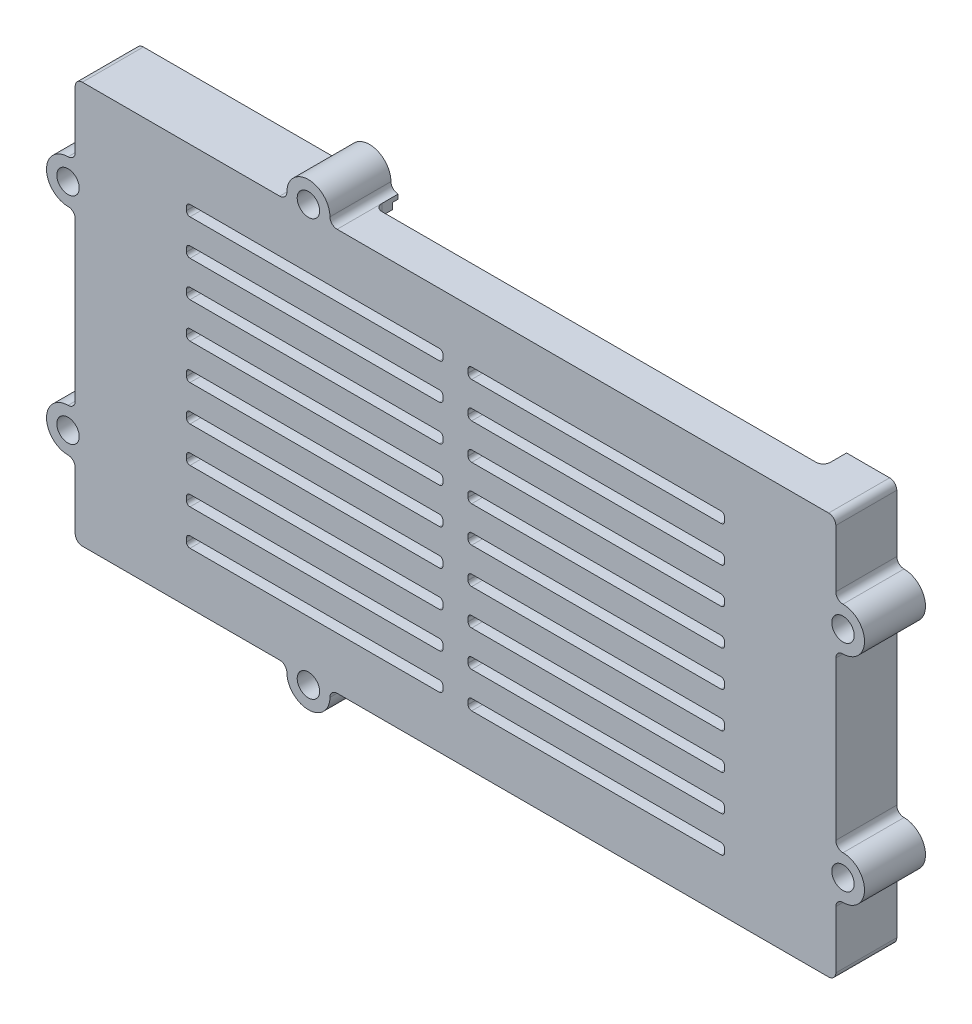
SolidWorks part; units mm, degrees
ref_plane "Alzado" through (0, 0, 0) normal (0, 0, 1) x (1, 0, 0)
ref_plane "Planta" through (0, 0, 0) normal (0, 1, 0) x (1, 0, 0)
ref_plane "Vista lateral" through (0, 0, 0) normal (1, 0, 0) x (0, 0, -1)
sketch "Croquis1" plane through (0, 0, 0) normal (0, 0, 1) x (1, 0, 0)
  line L0 (-96, -46) -> (96, 46) construction
  line L1 (-100, -50) -> (100, -50)
  line L2 (-100, -50) -> (-100, 50)
  line L3 (-100, 50) -> (100, 50)
  line L4 (100, -50) -> (100, 50)
  line L5 (-100, -50) -> (100, 50) construction
  line L6 (-100, 50) -> (100, -50) construction
  circle A0 centre (-96, 46) radius 1.75
  circle A1 centre (-96, -46) radius 1.75
  circle A2 centre (96, -46) radius 1.75
  circle A3 centre (96, 46) radius 1.75
  point P0 (0, 0)
  dimension "D3" = 3.5
  dimension "D4" = 192
  dimension "D5" = 92
  dimension "D1" = 200
  dimension "D2" = 100
sketch "Croquis2" plane through (0, 0, 0) normal (0, 0, 1) x (1, 0, 0)
  circle A0 centre (0, 0) radius 130
  dimension "D1" = 260
sketch "Croquis3" plane through (0, 0, 0) normal (0, 0, 1) x (1, 0, 0)
  line L0 (-100, 50) -> (100, 50) construction
  line L1 (-106, -56) -> (106, -56)
  line L2 (-106, -56) -> (-106, 56)
  line L3 (-106, 56) -> (106, 56)
  line L4 (106, -56) -> (106, 56)
  line L5 (-106, -56) -> (106, 56) construction
  line L6 (-106, 56) -> (106, -56) construction
  line L7 (-100, -50) -> (-100, 50) construction
  line L8 (-100, -50) -> (100, -50) construction
  line L9 (100, -50) -> (100, 50) construction
  circle A0 centre (-41, -58) radius 6
  circle A1 centre (-108, -30) radius 6
  circle A2 centre (-108, 30) radius 6
  circle A3 centre (-41, 58) radius 6
  circle A4 centre (108, -30) radius 6
  circle A5 centre (108, 30) radius 6
  point P0 (0, 0)
sketch "Croquis8" plane through (0, 0, 0) normal (0, 0, 1) x (1, 0, 0)
  line L0 (106, -56) -> (106, 56) construction
  line L1 (-106, 56) -> (106, 56) construction
  line L2 (-106, -56) -> (-106, 56) construction
  line L3 (-106, -56) -> (106, -56) construction
  line L4 (106, -56) -> (106, -35.6569)
  line L5 (-106, 56) -> (-46.6569, 56)
  line L6 (-106, -56) -> (-106, -35.6569)
  line L7 (-106, -56) -> (-46.6569, -56)
  line L8 (-35.3431, -56) -> (106, -56)
  line L9 (-106, -24.3431) -> (-106, 24.3431)
  line L10 (-106, 35.6569) -> (-106, 56)
  line L11 (-35.3431, 56) -> (106, 56)
  line L12 (106, 35.6569) -> (106, 56)
  line L13 (106, -24.3431) -> (106, 24.3431)
  circle A0 centre (108, 30) radius 6 construction
  circle A1 centre (-41, 58) radius 6 construction
  circle A2 centre (-108, 30) radius 6 construction
  circle A3 centre (-108, -30) radius 6 construction
  circle A4 centre (-41, -58) radius 6 construction
  circle A5 centre (108, -30) radius 6 construction
  arc A6 (106, 24.3431) -> (106, 35.6569) centre (108, 30) ccw
  arc A7 (-35.3431, 56) -> (-46.6569, 56) centre (-41, 58) ccw
  arc A8 (-106, 35.6569) -> (-106, 24.3431) centre (-108, 30) ccw
  arc A9 (-106, -24.3431) -> (-106, -35.6569) centre (-108, -30) ccw
  arc A10 (-46.6569, -56) -> (-35.3431, -56) centre (-41, -58) ccw
  arc A11 (106, -35.6569) -> (106, -24.3431) centre (108, -30) ccw
extrude "Saliente-Extruir5" add sketch "Croquis8" along normal blind 15.5
sketch "Croquis9" plane through (0, 0, 0) normal (0, 0, 1) x (1, 0, 0)
  line L0 (106, -56) -> (106, 56) construction
  line L1 (-106, -56) -> (106, -56) construction
  line L2 (-106, -56) -> (-106, 56) construction
  line L3 (-106, 56) -> (106, 56) construction
  line L4 (106, -56) -> (106, 56) construction
  line L5 (-106, -56) -> (106, -56) construction
  line L6 (-106, -56) -> (-106, 56) construction
  line L7 (-106, 56) -> (106, 56) construction
  line L8 (-103, 53) -> (-44.3166, 53)
  line L9 (103, -53) -> (103, -33.3166)
  line L10 (-103, -53) -> (-44.3166, -53)
  line L11 (-103, -53) -> (-103, -33.3166)
  line L12 (-37.6834, 53) -> (103, 53)
  line L13 (-103, 33.3166) -> (-103, 53)
  line L14 (-103, 53) -> (103, 53) construction
  line L15 (-103, -26.6834) -> (-103, 26.6834)
  line L16 (-103, -53) -> (-103, 53) construction
  line L17 (-37.6834, -53) -> (103, -53)
  line L18 (103, -26.6834) -> (103, 26.6834)
  line L19 (-103, -53) -> (103, -53) construction
  line L20 (103, 33.3166) -> (103, 53)
  line L21 (103, -53) -> (103, 53) construction
  line L22 (-100, -50) -> (100, -50) construction
  line L23 (-7.5, -50) -> (7.5, -50)
  line L24 (-7.5, -50) -> (-7.5, -47)
  line L25 (-7.5, -47) -> (7.5, -47)
  line L26 (7.5, -50) -> (7.5, -47)
  line L27 (0, -50) -> (0, 0) construction
  line L28 (-100, 50) -> (100, 50) construction
  line L29 (-7.5, 50) -> (7.5, 50)
  line L30 (-7.5, 50) -> (-7.5, 47)
  line L31 (-7.5, 47) -> (7.5, 47)
  line L32 (7.5, 50) -> (7.5, 47)
  circle A0 centre (-41, 58) radius 6 construction
  circle A1 centre (-108, 30) radius 6 construction
  circle A2 centre (-108, -30) radius 6 construction
  circle A3 centre (-41, -58) radius 6 construction
  circle A4 centre (108, -30) radius 6 construction
  circle A5 centre (108, 30) radius 6 construction
  arc A6 (-103, 26.6834) -> (-103, 33.3166) centre (-108, 30) ccw
  arc A7 (-103, -33.3166) -> (-103, -26.6834) centre (-108, -30) ccw
  arc A8 (-37.6834, -53) -> (-44.3166, -53) centre (-41, -58) ccw
  arc A9 (103, -26.6834) -> (103, -33.3166) centre (108, -30) ccw
  arc A10 (103, 33.3166) -> (103, 26.6834) centre (108, 30) ccw
  arc A11 (-44.3166, 53) -> (-37.6834, 53) centre (-41, 58) ccw
  circle A12 centre (96, 46) radius 1.15 construction
  circle A13 centre (96, 46) radius 4
  circle A14 centre (-96, 46) radius 1.15 construction
  circle A15 centre (-96, 46) radius 4
  circle A16 centre (-96, -46) radius 1.15 construction
  circle A17 centre (-96, -46) radius 4
  circle A18 centre (96, -46) radius 1.15 construction
  circle A19 centre (96, -46) radius 4
  dimension "D2" = 2.3
  dimension "D3" = 8
  dimension "D4" = 15
  dimension "D5" = 3
  dimension "D6" = 3
  dimension "D1" = 3
extrude "Cortar-Extruir1" cut sketch "Croquis9" along normal blind 12.5
sketch "Croquis14" plane through (0, 0, 15.5) normal (0, 0, 1) x (1, 0, 0)
  circle A0 centre (-41, 58) radius 6 construction
  circle A1 centre (-108, -30) radius 6 construction
  circle A2 centre (-41, -58) radius 6 construction
  circle A3 centre (108, 30) radius 6 construction
  circle A4 centre (108, -30) radius 6 construction
  circle A5 centre (-41, 58) radius 6
  circle A6 centre (-108, -30) radius 6
  circle A7 centre (-41, -58) radius 6
  circle A8 centre (108, 30) radius 6
  circle A9 centre (108, -30) radius 6
  circle A10 centre (-108, 30) radius 6 construction
  circle A11 centre (-108, 30) radius 6
sketch "Croquis17" plane through (0, 0, 12.5) normal (0, 0, -1) x (-1, 0, 0)
  line L0 (-7.5, -47) -> (7.5, -47) construction
  line L1 (1.5, 47) -> (-1.5, 47)
  line L2 (1.5, 47) -> (1.5, -47)
  line L3 (1.5, -47) -> (-1.5, -47)
  line L4 (-1.5, 47) -> (-1.5, -47)
  line L5 (1.5, 47) -> (-1.5, -47) construction
  line L6 (1.5, -47) -> (-1.5, 47) construction
  point P0 (0, 0)
  dimension "D1" = 3
extrude "Saliente-Extruir8" add sketch "Croquis17" along normal blind 5
fillet "Redondeo4" radius 2 52 edges at (-102, 30, 12.5) (-103, 0, 12.5) (-102, -30, 12.5) (-103, -43.1583, 12.5) (-73.6583, -53, 12.5) (-41, -52, 12.5) (32.6583, -53, 12.5) (103, -43.1583, 12.5) (102, -30, 12.5) (103, 0, 12.5) (102, 30, 12.5) (103, 43.1583, 12.5) (32.6583, 53, 12.5) (-41, 52, 12.5) (-73.6583, 53, 12.5) (-103, 43.1583, 12.5) (-106, -56, 7.75) (-106, 56, 7.75) (106, 56, 7.75) (106, -56, 7.75) (-103, -53, 6.25) (-103, 53, 6.25) (103, -53, 6.25) (103, 53, 6.25) (106, 35.6569, 7.75) (106, 24.3431, 7.75) (106, -24.3431, 7.75) (106, -35.6569, 7.75) (-35.3431, -56, 7.75) (-46.6569, -56, 7.75) (-106, -35.6569, 7.75) (-106, -24.3431, 7.75) (-106, 24.3431, 7.75) (-106, 35.6569, 7.75) (-46.6569, 56, 7.75) (-35.3431, 56, 7.75) (100, -46, 12.5) (-92, 46, 12.5) (100, 46, 12.5) (-92, -46, 12.5) (-7.5, 48.5, 12.5) (0, 50, 12.5) (7.5, 48.5, 12.5) (4.5, 47, 12.5) (-4.5, 47, 12.5) (-7.5, -48.5, 12.5) (-4.5, -47, 12.5) (4.5, -47, 12.5) (7.5, -48.5, 12.5) (0, -50, 12.5) (-1.5, 0, 12.5) (1.5, 0, 12.5)
sketch "Croquis10" plane through (0, 0, 0) normal (0, 0, 1) x (1, 0, 0)
  line L0 (-104, -54.75) -> (-49, -54.75)
  line L1 (-33, -54.75) -> (104, -54.75)
  line L2 (104.75, -54) -> (104.75, -38)
  line L3 (104.75, -22) -> (104.75, 22)
  line L4 (104.75, 38) -> (104.75, 54)
  line L5 (104, 54.75) -> (-33, 54.75)
  line L6 (-49, 54.75) -> (-104, 54.75)
  line L7 (-104.75, 54) -> (-104.75, 38)
  line L8 (-104.75, 22) -> (-104.75, -22)
  line L9 (-104.75, -38) -> (-104.75, -54)
  line L10 (-104, -56) -> (-49, -56)
  line L11 (-106, -38) -> (-106, -54)
  line L12 (-106, 22) -> (-106, -22)
  line L13 (-106, 54) -> (-106, 38)
  line L14 (-49, 56) -> (-104, 56)
  line L15 (104, 56) -> (-33, 56)
  line L16 (106, 38) -> (106, 54)
  line L17 (106, -22) -> (106, 22)
  line L18 (106, -54) -> (106, -38)
  line L19 (-33, -56) -> (104, -56)
  line L20 (-104, -56) -> (-49, -56)
  line L21 (-106, -38) -> (-106, -54)
  line L22 (-106, 22) -> (-106, -22)
  line L23 (-106, 54) -> (-106, 38)
  line L24 (-49, 56) -> (-104, 56)
  line L25 (104, 56) -> (-33, 56)
  line L26 (106, 38) -> (106, 54)
  line L27 (106, -22) -> (106, 22)
  line L28 (106, -54) -> (106, -38)
  line L29 (-33, -56) -> (104, -56)
  arc A0 (-45.75, -58) -> (-49, -54.75) centre (-49, -58) ccw
  arc A1 (-45.75, -58) -> (-36.25, -58) centre (-41, -58) ccw
  arc A2 (-33, -54.75) -> (-36.25, -58) centre (-33, -58) ccw
  arc A3 (104, -54.75) -> (104.75, -54) centre (104, -54) ccw
  arc A4 (108, -34.75) -> (104.75, -38) centre (108, -38) ccw
  arc A5 (108, -34.75) -> (108, -25.25) centre (108, -30) ccw
  arc A6 (104.75, -22) -> (108, -25.25) centre (108, -22) ccw
  arc A7 (108, 25.25) -> (104.75, 22) centre (108, 22) ccw
  arc A8 (108, 25.25) -> (108, 34.75) centre (108, 30) ccw
  arc A9 (104.75, 38) -> (108, 34.75) centre (108, 38) ccw
  arc A10 (104.75, 54) -> (104, 54.75) centre (104, 54) ccw
  arc A11 (-36.25, 58) -> (-33, 54.75) centre (-33, 58) ccw
  arc A12 (-36.25, 58) -> (-45.75, 58) centre (-41, 58) ccw
  arc A13 (-49, 54.75) -> (-45.75, 58) centre (-49, 58) ccw
  arc A14 (-104, 54.75) -> (-104.75, 54) centre (-104, 54) ccw
  arc A15 (-108, 34.75) -> (-104.75, 38) centre (-108, 38) ccw
  arc A16 (-108, 34.75) -> (-108, 25.25) centre (-108, 30) ccw
  arc A17 (-104.75, 22) -> (-108, 25.25) centre (-108, 22) ccw
  arc A18 (-108, -25.25) -> (-104.75, -22) centre (-108, -22) ccw
  arc A19 (-108, -25.25) -> (-108, -34.75) centre (-108, -30) ccw
  arc A20 (-104.75, -38) -> (-108, -34.75) centre (-108, -38) ccw
  arc A21 (-104.75, -54) -> (-104, -54.75) centre (-104, -54) ccw
  arc A22 (-106, -54) -> (-104, -56) centre (-104, -54) ccw
  arc A23 (-106, -38) -> (-108, -36) centre (-108, -38) ccw
  arc A24 (-108, -24) -> (-108, -36) centre (-108, -30) ccw
  arc A25 (-108, -24) -> (-106, -22) centre (-108, -22) ccw
  arc A26 (-106, 22) -> (-108, 24) centre (-108, 22) ccw
  arc A27 (-108, 36) -> (-108, 24) centre (-108, 30) ccw
  arc A28 (-108, 36) -> (-106, 38) centre (-108, 38) ccw
  arc A29 (-104, 56) -> (-106, 54) centre (-104, 54) ccw
  arc A30 (-49, 56) -> (-47, 58) centre (-49, 58) ccw
  arc A31 (-35, 58) -> (-47, 58) centre (-41, 58) ccw
  arc A32 (-35, 58) -> (-33, 56) centre (-33, 58) ccw
  arc A33 (106, 54) -> (104, 56) centre (104, 54) ccw
  arc A34 (106, 38) -> (108, 36) centre (108, 38) ccw
  arc A35 (108, 24) -> (108, 36) centre (108, 30) ccw
  arc A36 (108, 24) -> (106, 22) centre (108, 22) ccw
  arc A37 (106, -22) -> (108, -24) centre (108, -22) ccw
  arc A38 (108, -36) -> (108, -24) centre (108, -30) ccw
  arc A39 (108, -36) -> (106, -38) centre (108, -38) ccw
  arc A40 (104, -56) -> (106, -54) centre (104, -54) ccw
  arc A41 (-33, -56) -> (-35, -58) centre (-33, -58) ccw
  arc A42 (-47, -58) -> (-35, -58) centre (-41, -58) ccw
  arc A43 (-47, -58) -> (-49, -56) centre (-49, -58) ccw
  arc A44 (-106, -54) -> (-104, -56) centre (-104, -54) ccw
  arc A45 (-106, -38) -> (-108, -36) centre (-108, -38) ccw
  arc A46 (-108, -24) -> (-108, -36) centre (-108, -30) ccw
  arc A47 (-108, -24) -> (-106, -22) centre (-108, -22) ccw
  arc A48 (-106, 22) -> (-108, 24) centre (-108, 22) ccw
  arc A49 (-108, 36) -> (-108, 24) centre (-108, 30) ccw
  arc A50 (-108, 36) -> (-106, 38) centre (-108, 38) ccw
  arc A51 (-104, 56) -> (-106, 54) centre (-104, 54) ccw
  arc A52 (-49, 56) -> (-47, 58) centre (-49, 58) ccw
  arc A53 (-35, 58) -> (-47, 58) centre (-41, 58) ccw
  arc A54 (-35, 58) -> (-33, 56) centre (-33, 58) ccw
  arc A55 (106, 54) -> (104, 56) centre (104, 54) ccw
  arc A56 (106, 38) -> (108, 36) centre (108, 38) ccw
  arc A57 (108, 24) -> (108, 36) centre (108, 30) ccw
  arc A58 (108, 24) -> (106, 22) centre (108, 22) ccw
  arc A59 (106, -22) -> (108, -24) centre (108, -22) ccw
  arc A60 (108, -36) -> (108, -24) centre (108, -30) ccw
  arc A61 (108, -36) -> (106, -38) centre (108, -38) ccw
  arc A62 (104, -56) -> (106, -54) centre (104, -54) ccw
  arc A63 (-33, -56) -> (-35, -58) centre (-33, -58) ccw
  arc A64 (-47, -58) -> (-35, -58) centre (-41, -58) ccw
  arc A65 (-47, -58) -> (-49, -56) centre (-49, -58) ccw
  dimension "D1" = 0
  dimension "D2" = 1.25
extrude "Saliente-Extruir6" add sketch "Croquis10" against normal blind 1.5
sketch "Croquis13" plane through (0, 0, 0) normal (0, 0, -1) x (-1, 0, 0)
  circle A0 centre (-96, -46) radius 1.15 construction
  circle A1 centre (96, -46) radius 1.15 construction
  circle A2 centre (96, 46) radius 1.15 construction
  circle A3 centre (-96, 46) radius 1.15 construction
  circle A4 centre (-96, -46) radius 1.15
  circle A5 centre (96, -46) radius 1.15
  circle A6 centre (96, 46) radius 1.15
  circle A7 centre (-96, 46) radius 1.15
extrude "Cortar-Extruir2" cut sketch "Croquis13" against normal blind 11
sketch "Croquis15" plane through (0, 0, -1.5) normal (0, 0, -1) x (-1, 0, 0)
  line L0 (-100, -50) -> (-100, 50) construction
  line L1 (106, 56) -> (-106, 56) construction
  line L2 (-92, 56) -> (33, 56)
  line L3 (-92, 56) -> (-92, 54.75)
  line L4 (-92, 54.75) -> (33, 54.75)
  line L5 (33, 56) -> (33, 54.75)
  line L6 (-104, 54.75) -> (33, 54.75) construction
  line L8 (100, -50) -> (100, 50) construction
  line L9 (106, -56) -> (-106, -56) construction
  line L10 (-92, -56) -> (33, -56)
  line L11 (-92, -56) -> (-92, -54.75)
  line L12 (-92, -54.75) -> (33, -54.75)
  line L13 (33, -56) -> (33, -54.75)
  line L14 (33, -54.75) -> (-104, -54.75) construction
  line L15 (104.75, 22) -> (104.75, -22) construction
  line L16 (104.75, 14) -> (106, 14)
  line L17 (104.75, 14) -> (104.75, -14)
  line L18 (104.75, -14) -> (106, -14)
  line L19 (106, 14) -> (106, -14)
  line L20 (106, -56) -> (106, 56) construction
  line L21 (100, 50) -> (-100, 50) construction
  line L22 (100, -50) -> (-100, -50) construction
  dimension "D1" = 8
  dimension "D2" = 67
  dimension "D3" = 36
  dimension "D4" = 36
extrude "Cortar-Extruir3" cut sketch "Croquis15" against normal up to surface (1.5 mm away)
sketch "Croquis16" plane through (0, 0, 12.5) normal (0, 0, -1) x (-1, 0, 0)
  line L1 (74, -38.5) -> (-74, -38.5) construction
  line L2 (75, -39.5) -> (75, -40.5)
  line L3 (74, -41.5) -> (-74, -41.5) construction
  line L4 (-75, -39.5) -> (-75, -40.5)
  line L5 (75, -38.5) -> (-75, -41.5) construction
  line L6 (75, -41.5) -> (-75, -38.5) construction
  line L7 (3.5, -40.5) -> (3.5, -39.5)
  line L8 (3.5, 45) -> (3.5, -45) construction
  line L10 (-3.5, -40.5) -> (-3.5, -39.5)
  line L11 (-3.5, -45) -> (-3.5, 45) construction
  line L12 (4.5, -41.5) -> (74, -41.5)
  line L14 (74, -38.5) -> (4.5, -38.5)
  line L16 (-4.5, -41.5) -> (-74, -41.5)
  line L17 (-74, -38.5) -> (-4.5, -38.5)
  arc A0 (-74, -38.5) -> (-75, -39.5) centre (-74, -39.5) ccw
  arc A1 (-74, -41.5) -> (-75, -40.5) centre (-74, -40.5) cw
  arc A2 (74, -38.5) -> (75, -39.5) centre (74, -39.5) cw
  arc A3 (75, -40.5) -> (74, -41.5) centre (74, -40.5) cw
  arc A4 (-3.5, -40.5) -> (-4.5, -41.5) centre (-4.5, -40.5) cw
  arc A5 (-3.5, -39.5) -> (-4.5, -38.5) centre (-4.5, -39.5) ccw
  arc A6 (3.5, -39.5) -> (4.5, -38.5) centre (4.5, -39.5) cw
  arc A7 (3.5, -40.5) -> (4.5, -41.5) centre (4.5, -40.5) ccw
  point P0 (0, -40)
  point P28 (-3.5, -41.5)
  point P31 (-3.5, -38.5)
  point P34 (3.5, -38.5)
  point P37 (3.5, -41.5)
  dimension "D4" = 1
  dimension "D5" = 1
  dimension "D1" = 40
  dimension "D2" = 150
  dimension "D3" = 3
extrude "Cortar-Extruir5" cut sketch "Croquis16" against normal up to next
pattern_linear "MatrizL2" count 9 spacing 10 along (0, 1, 0) of "Cortar-Extruir5"
sketch "Croquis18" plane through (0, 0, 15.5) normal (0, 0, 1) x (1, 0, 0)
  circle A0 centre (-108, 30) radius 3.125
  circle A1 centre (-108, -30) radius 3.125
  circle A2 centre (108, 30) radius 3.125
  circle A3 centre (108, -30) radius 3.125
  circle A4 centre (-41, 58) radius 3.125
  circle A5 centre (-41, -58) radius 3.125
  dimension "D1" = 6.25
extrude "Cortar-Extruir6" cut sketch "Croquis18" against normal blind 12.5
sketch "Croquis19" plane through (0, 0, 3) normal (0, 0, 1) x (1, 0, 0)
  circle A0 centre (-108, 30) radius 1.6
  circle A1 centre (-41, 58) radius 1.6
  circle A2 centre (108, 30) radius 1.6
  circle A3 centre (108, -30) radius 1.6
  circle A4 centre (-41, -58) radius 1.6
  circle A5 centre (-108, -30) radius 1.6
  dimension "D1" = 3.2
extrude "Cortar-Extruir7" cut sketch "Croquis19" against normal up to next
sketch "Croquis20" plane through (0, -56, 0) normal (0, -1, 0) x (1, 0, 0)
  line L1 (-104, -1.5) -> (-49, -1.5) construction
  circle A0 centre (-76.5, -1.5) radius 1.25
  dimension "D1" = 2.5
extrude "Cortar-Extruir8" cut sketch "Croquis20" against normal up to next
sketch "Croquis22" plane through (0, 0, 0) normal (0, 0, -1) x (-1, 0, 0)
  line L0 (-7.5, -50) -> (7.5, -50) construction
  line L1 (7.5, -50) -> (7.5, -47) construction
  line L2 (7.5, -47) -> (-7.5, -47) construction
  line L3 (-7.5, -47) -> (-7.5, -50) construction
  line L4 (-7.5, 47) -> (7.5, 47) construction
  line L5 (7.5, 47) -> (7.5, 50) construction
  line L6 (7.5, 50) -> (-7.5, 50) construction
  line L7 (-7.5, 50) -> (-7.5, 47) construction
  line L8 (-7.5, -50) -> (7.5, -50)
  line L9 (7.5, -50) -> (7.5, -47)
  line L10 (7.5, -47) -> (-7.5, -47)
  line L11 (-7.5, -47) -> (-7.5, -50)
  line L12 (-7.5, 47) -> (7.5, 47)
  line L13 (7.5, 47) -> (7.5, 50)
  line L14 (7.5, 50) -> (-7.5, 50)
  line L15 (-7.5, 50) -> (-7.5, 47)
  circle A0 centre (-96, -46) radius 4 construction
  circle A1 centre (96, -46) radius 4 construction
  circle A2 centre (96, 46) radius 4 construction
  circle A3 centre (-96, 46) radius 4 construction
  circle A4 centre (-96, -46) radius 4
  circle A5 centre (96, -46) radius 4
  circle A6 centre (96, 46) radius 4
  circle A7 centre (-96, 46) radius 4
extrude "Cortar-Extruir9" cut sketch "Croquis22" against normal blind 1.5
sketch "Croquis23" plane through (0, 0, 0) normal (0, 0, -1) x (-1, 0, 0)
  line L0 (-101, 53) -> (37.6834, 53) construction
  line L1 (-92, 56) -> (33, 56)
  line L2 (-92, 56) -> (-92, 53)
  line L3 (-92, 53) -> (33, 53)
  line L4 (33, 56) -> (33, 53)
  line L5 (37.6834, -53) -> (-101, -53) construction
  line L6 (-92, -56) -> (33, -56)
  line L7 (-92, -56) -> (-92, -53)
  line L8 (-92, -53) -> (33, -53)
  line L9 (33, -56) -> (33, -53)
  point P15 (0, 0)
extrude "Cortar-Extruir10" cut sketch "Croquis23" against normal blind 5
fillet "Redondeo5" radius 2 4 edges at (92, 54.5, 5) (-33, 54.5, 5) (-33, -54.5, 5) (92, -54.5, 5)
equation "\"D6@Croquis3\"=\"D4@Croquis3\""
equation "\"D7@Croquis3\"=\"D3@Croquis3\"/2+2"
equation "\"D8@Croquis3\"=\"D7@Croquis3\""
equation "\"D9@Croquis3\"=\"D7@Croquis3\""
equation "\"D10@Croquis3\"=\"D7@Croquis3\""
